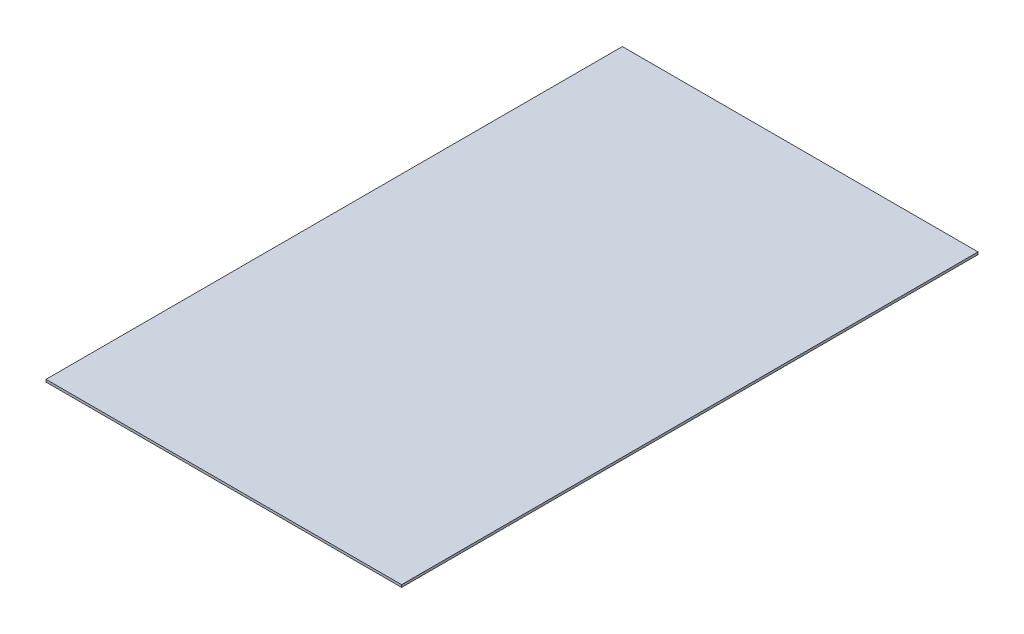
SolidWorks part; units mm, degrees
ref_plane "Front Plane" through (0, 0, 0) normal (0, 0, 1) x (1, 0, 0)
ref_plane "Top Plane" through (0, 0, 0) normal (0, 1, 0) x (1, 0, 0)
ref_plane "Right Plane" through (0, 0, 0) normal (1, 0, 0) x (0, 0, -1)
sketch "Sketch1" plane through (0, 0, 0) normal (0, 1, 0) x (1, 0, 0)
  line L0 (0, 0) -> (0, 2387.6)
  line L1 (0, 0) -> (1473.2, 0)
  line L2 (0, 2387.6) -> (1473.2, 2387.6)
  line L3 (1473.2, 0) -> (1473.2, 2387.6)
  dimension "D1" = 2387.6
  dimension "D2" = 1473.2
extrude "Boss-Extrude1" add sketch "Sketch1" along normal blind 10
